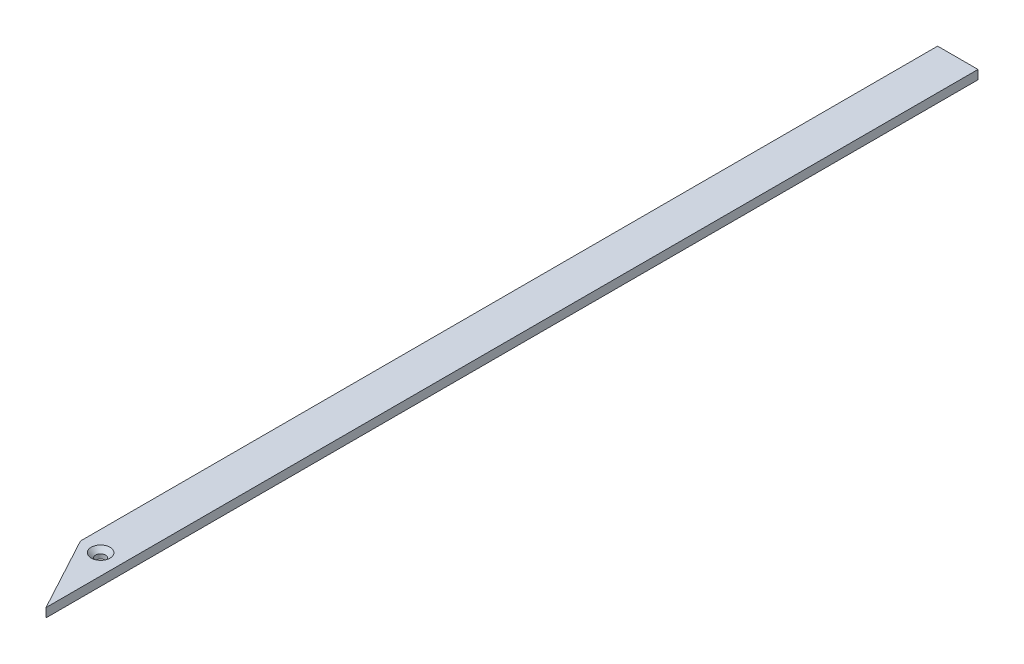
SolidWorks part; units mm, degrees
ref_plane "Plan de face" through (0, 0, 0) normal (0, 0, 1) x (1, 0, 0)
ref_plane "Plan de dessus" through (0, 0, 0) normal (0, 1, 0) x (1, 0, 0)
ref_plane "Plan de droite" through (0, 0, 0) normal (1, 0, 0) x (0, 0, -1)
sketch "Esquisse1" plane through (0, 0, 0) normal (0, 0, 1) x (1, 0, 0)
  line L1 (-13.5, 0) -> (13.5, 0)
  line L2 (-13.5, 0) -> (-13.5, 6)
  line L3 (-13.5, 6) -> (13.5, 6)
  line L4 (13.5, 0) -> (13.5, 6)
  point P4 (0, 0)
  dimension "D1" = 27
  dimension "D2" = 6
extrude "Extrusion1" add sketch "Esquisse1" along normal mid plane 623
hole_wizard "Fraisage pour vis à tête fraisée M61" positions "Esquisse3" profile "Esquisse2" countersink size "M6" standard "ISO"
sketch "Esquisse3" plane through (0, 6, 0) normal (0, 1, 0) x (-1, 0, 0)
  line L1 (-13.5, 311.5) -> (-13.5, -311.5) construction
  line L2 (-13.5, 311.5) -> (13.5, 311.5) construction
  point P0 (0, 261.5)
  dimension "D1" = 50
  dimension "D2" = 13.5
sketch "Esquisse2" plane through (0, 6, 261.5) normal (1, 0, 0) x (0, 0, 1)
  line L0 (0, 0) -> (0, 6)
  line L1 (0, 6) -> (3.3, 6)
  line L2 (3.3, 6) -> (3.3, 3)
  line L3 (3.3, 3) -> (6.3, 0)
  line L5 (6.3, 0) -> (0, 0)
  line L6 (-3.3, 3) -> (-6.3, 0) construction
  line L11 (0, -6.35) -> (0, 107.95) construction
  dimension "Diamètre du perçage jusqu'au prochain" = 6.6
  dimension "Profondeur du perçage jusqu'au prochain" = 6
  dimension "Diamètre du fraisage entrant" = 12.6
  dimension "Angle du fraisage entrant" = 90
chamfer "Chanfrein3" distance 50 distance2 27 1 edges at (-13.5, 3, 311.5)
